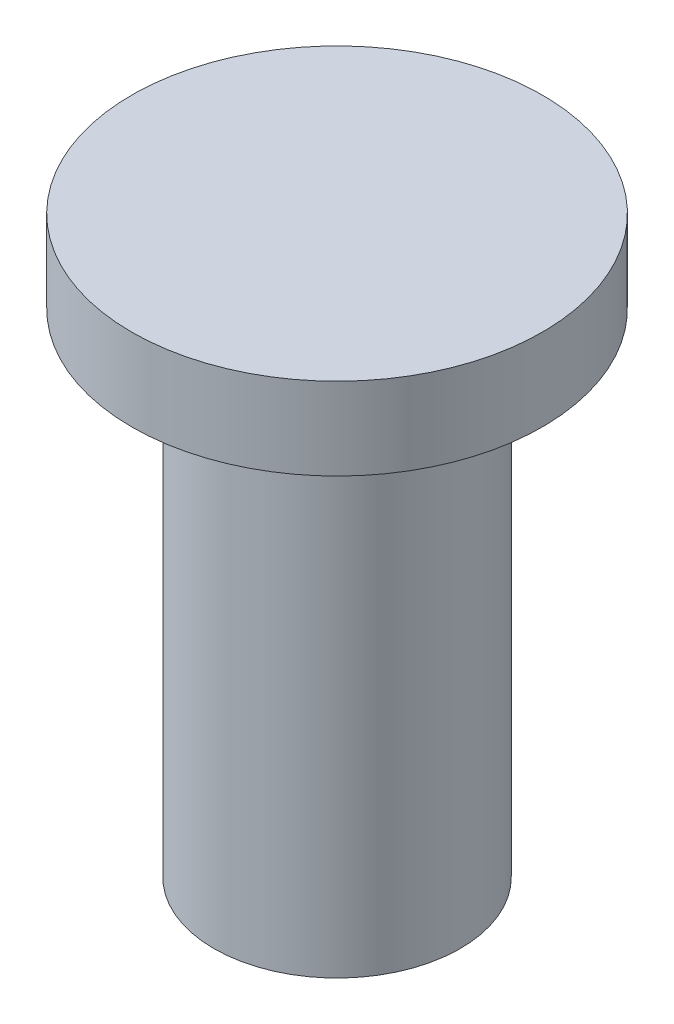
SolidWorks part; units mm, degrees
ref_plane "Front Plane" through (0, 0, 0) normal (0, 0, 1) x (1, 0, 0)
ref_plane "Top Plane" through (0, 0, 0) normal (0, 1, 0) x (1, 0, 0)
ref_plane "Right Plane" through (0, 0, 0) normal (1, 0, 0) x (0, 0, -1)
sketch "Sketch1" plane through (0, 0, 0) normal (0, 1, 0) x (1, 0, 0)
  circle A0 centre (0, 0) radius 7.5
  dimension "D1" = 15
extrude "Boss-Extrude1" add sketch "Sketch1" along normal blind 30
sketch "Sketch2" plane through (0, 30, 0) normal (0, 1, 0) x (1, 0, 0)
  circle A0 centre (0, 0) radius 12.5
  dimension "D1" = 25
extrude "Boss-Extrude2" add sketch "Sketch2" along normal blind 5
scale "Scale1" scale about centroid uniform scaling yes scale factor 0.9
